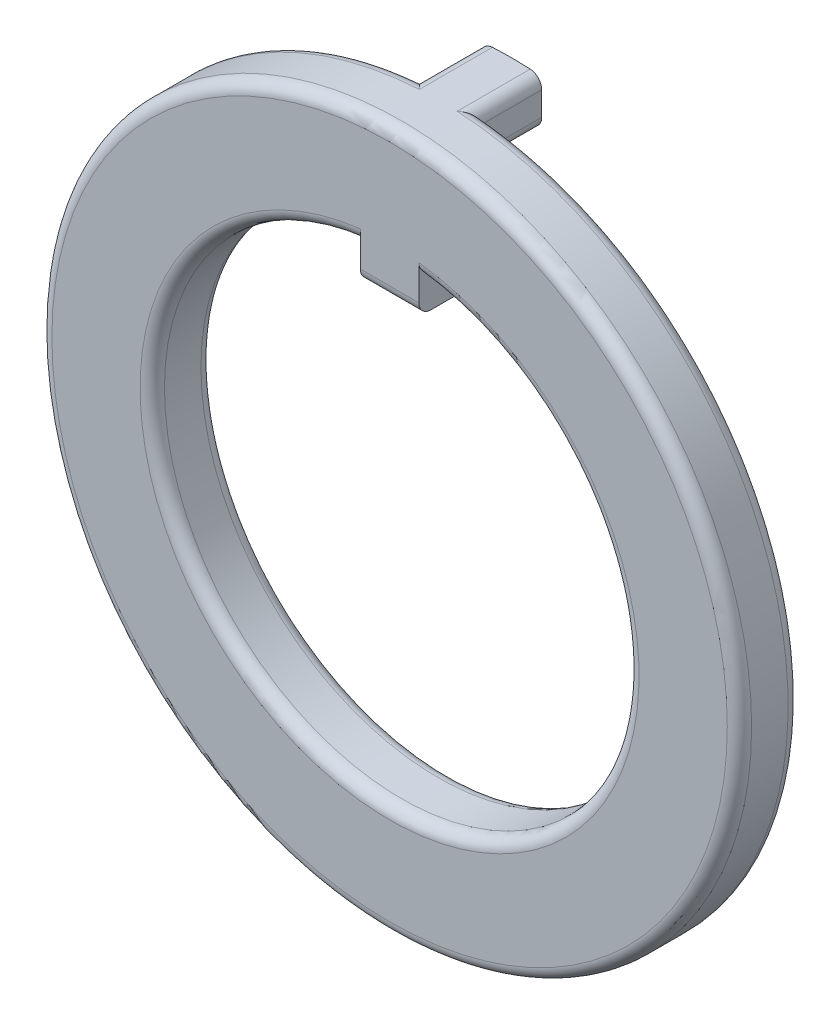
SolidWorks part; units mm, degrees
ref_plane "Plan de face" through (0, 0, 0) normal (0, 0, 1) x (1, 0, 0)
ref_plane "Plan de dessus" through (0, 0, 0) normal (0, 1, 0) x (1, 0, 0)
ref_plane "Plan de droite" through (0, 0, 0) normal (1, 0, 0) x (0, 0, -1)
sketch "Esquisse1" plane through (0, 0, 0) normal (0, 0, 1) x (1, 0, 0)
  line L0 (0, 7.8334) -> (0, -7.8334) construction
  line L2 (-0.48, 3.8703) -> (-0.48, 3.3)
  line L3 (-0.48, 3.3) -> (0.48, 3.3)
  line L4 (0.48, 3.3) -> (0.48, 3.8703)
  circle A0 centre (0, 0) radius 5.75
  arc A1 (0.48, 3.8703) -> (-0.48, 3.8703) centre (0, 0) cw
  dimension "D1" = 11.5
  dimension "D2" = 0.96
  dimension "D5" = 3.3
  dimension "D4" = 3.9
  dimension "D3" = 0.48
extrude "Boss.-Extru.1" add sketch "Esquisse1" along normal blind 2
sketch "Esquisse2" plane through (0, 0, 0) normal (1, 0, 0) x (0, 0, -1)
  line L0 (-2, 5.75) -> (-2, -5.75) construction
  line L1 (-1, 4.95) -> (2.3589, 4.95)
  line L2 (-1, 4.95) -> (-1, -7.05)
  line L3 (-1, -7.05) -> (2.3589, -7.05)
  line L4 (2.3589, 4.95) -> (2.3589, -7.05)
  line L5 (0, 5.75) -> (-2, 5.75) construction
  dimension "D1" = 1
  dimension "D2" = 3.3589
  dimension "D3" = 0.8
  dimension "D4" = 12
extrude "Enlèv. mat.-Extru.1" cut sketch "Esquisse2" against normal mid plane 20
sketch "Esquisse3" plane through (0, 0, 0) normal (0, 0, -1) x (-1, 0, 0)
  line L0 (0, 7.3034) -> (0, -0.6769) construction
  line L3 (0.5, 8) -> (3.5, 8)
  line L4 (0.5, 8) -> (0.5, 3)
  line L5 (0.5, 3) -> (3.5, 3)
  line L6 (3.5, 8) -> (3.5, 3)
  line L7 (-4.5, 8) -> (-0.5, 8)
  line L8 (-4.5, 8) -> (-4.5, 3)
  line L9 (-4.5, 3) -> (-0.5, 3)
  line L10 (-0.5, 8) -> (-0.5, 3)
  dimension "D1" = 0.5
  dimension "D2" = 1
  dimension "D3" = 8
  dimension "D4" = 4
  dimension "D5" = 5
  dimension "D6" = 5
  dimension "D7" = 3
  dimension "D8" = 3
extrude "Enlèv. mat.-Extru.2" cut sketch "Esquisse3" against normal blind 1
fillet "Congé1" radius 0.2 1 edges at (0, -5.75, 1)
fillet "Congé4" radius 0.2 2 edges at (0, -3.9, 2) (5.75, 0, 2)
fillet "Congé5" radius 0.2 1 edges at (0, -3.9, 1)
fillet "Congé6" radius 0.2 1 edges at (0, 3.3, 1)
fillet "Congé7" radius 0.2 4 edges at (0.5, 5.7282, 0.6) (0.5, 4.95, 0.5) (-0.5, 4.95, 0.5) (-0.5, 5.7282, 0.6)
fillet "Congé8" radius 0.2 1 edges at (0, 3.3, 2)
